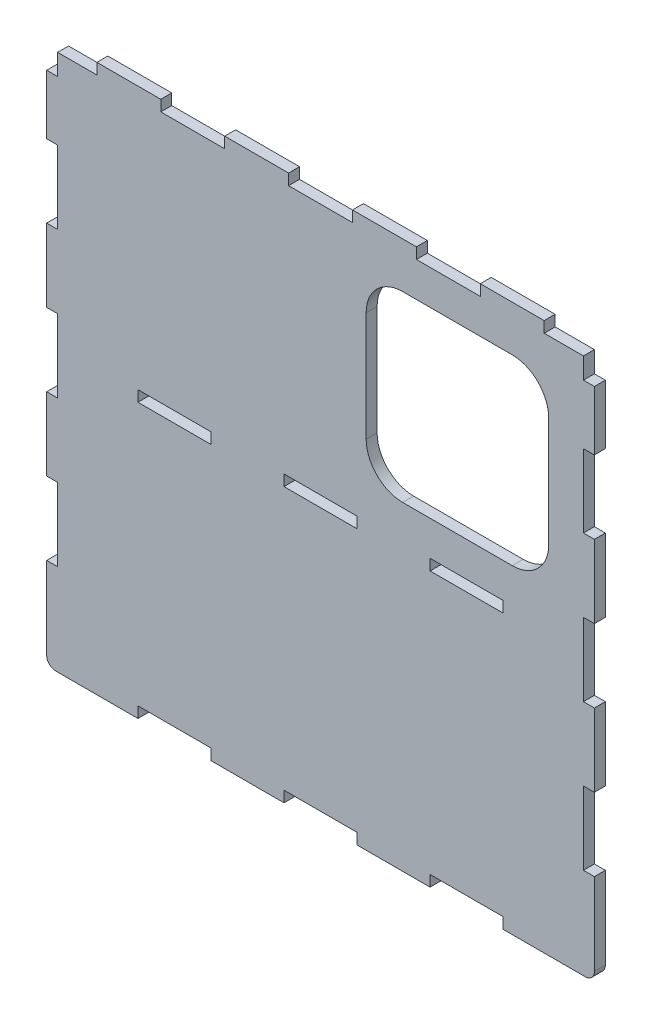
SolidWorks part; units mm, degrees
ref_plane "Alzado" through (0, 0, 0) normal (0, 0, 1) x (1, 0, 0)
ref_plane "Planta" through (0, 0, 0) normal (0, 1, 0) x (1, 0, 0)
ref_plane "Vista lateral" through (0, 0, 0) normal (1, 0, 0) x (0, 0, -1)
sketch "Sketch1" plane through (0, 0, 0) normal (0, 0, 1) x (1, 0, 0)
  line L0 (0, 0) -> (300, 0) construction
  line L2 (-300, 290) -> (-300, 200)
  line L3 (-290, -300) -> (-200, -300)
  line L4 (300, 290) -> (300, 200)
  line L5 (-294.0346, 294.0346) -> (300, -300) construction
  line L6 (-300, -300) -> (300, 300) construction
  line L8 (-200, -300) -> (-200, -288)
  line L9 (-200, -288) -> (-120, -288)
  line L10 (-120, -300) -> (-120, -288)
  line L12 (-40, -300) -> (-40, -288)
  line L13 (-40, -288) -> (40, -288)
  line L14 (40, -300) -> (40, -288)
  line L16 (120, -300) -> (120, -288)
  line L17 (120, -288) -> (200, -288)
  line L18 (200, -300) -> (200, -288)
  line L19 (-120, -300) -> (-40, -300)
  line L20 (40, -300) -> (120, -300)
  line L21 (200, -300) -> (290, -300)
  line L34 (0, 0) -> (0, 288) construction
  line L35 (-300, -200) -> (-288, -200)
  line L37 (-300, -120) -> (-288, -120)
  line L38 (-288, -200) -> (-288, -120)
  line L39 (-300, -40) -> (-288, -40)
  line L41 (-300, 40) -> (-288, 40)
  line L42 (-288, -40) -> (-288, 40)
  line L43 (-300, 120) -> (-288, 120)
  line L45 (-300, 200) -> (-288, 200)
  line L46 (-288, 120) -> (-288, 200)
  line L47 (-300, 120) -> (-300, 40)
  line L48 (-300, -40) -> (-300, -120)
  line L49 (-300, -200) -> (-300, -290)
  line L50 (300, -120) -> (288, -120)
  line L51 (288, -200) -> (288, -120)
  line L52 (300, -200) -> (288, -200)
  line L53 (300, 40) -> (288, 40)
  line L54 (288, -40) -> (288, 40)
  line L55 (300, -40) -> (288, -40)
  line L56 (300, 200) -> (288, 200)
  line L57 (288, 120) -> (288, 200)
  line L58 (300, 120) -> (288, 120)
  line L59 (300, -200) -> (300, -290)
  line L60 (300, -40) -> (300, -120)
  line L61 (300, 120) -> (300, 40)
  line L63 (-175, 288) -> (-105, 288)
  line L64 (-105, 288) -> (-105, 300)
  line L65 (-105, 300) -> (-35, 300)
  line L66 (-35, 300) -> (-35, 288)
  line L67 (-35, 288) -> (35, 288)
  line L68 (35, 288) -> (35, 300)
  line L69 (35, 300) -> (105, 300)
  line L70 (105, 300) -> (105, 288)
  line L71 (105, 288) -> (175, 288)
  line L74 (175, 288) -> (175, 300)
  line L76 (175, 300) -> (290, 300)
  line L77 (-175, 288) -> (-175, 300)
  line L78 (-175, 300) -> (-290, 300)
  arc A0 (290, -300) -> (300, -290) centre (290, -290) ccw
  arc A1 (290, 300) -> (300, 290) centre (290, 290) cw
  arc A2 (-300, -290) -> (-290, -300) centre (-290, -290) ccw
  arc A3 (-290, 300) -> (-300, 290) centre (-290, 290) ccw
  point P0 (0, 0)
  dimension "D3" = 10
  dimension "D2" = 600
  dimension "D4" = 100
  dimension "D5" = 80
  dimension "D6" = 12
  dimension "D7" = 12
  dimension "D8" = 80
  dimension "D9" = 80
  dimension "D10" = 80
  dimension "D11" = 12
  dimension "D12" = 80
  dimension "D13" = 100
  dimension "D14" = 12
  dimension "D15" = 80
  dimension "D16" = 80
  dimension "D17" = 12
  dimension "D18" = 80
  dimension "D19" = 80
  dimension "D20" = 12
  dimension "D21" = 80
  dimension "D22" = 12
  dimension "D23" = 12
  dimension "D24" = 12
  dimension "D25" = 12
  dimension "D26" = 115
  dimension "D27" = 70
  dimension "D28" = 70
  dimension "D29" = 70
  dimension "D30" = 70
  dimension "D31" = 12
  dimension "D32" = 70
  dimension "D33" = 115
  dimension "D34" = 600
extrude "Boss-Extrude1" add sketch "Sketch1" along normal blind 12
sketch "Sketch2" plane through (0, 0, 12) normal (0, 0, 1) x (1, 0, 0)
  line L0 (-300, 290) -> (-300, 200) construction
  line L5 (300, 40) -> (300, 120) construction
  line L6 (90, 250) -> (210, 250)
  line L7 (-300, 265) -> (-288, 265)
  line L8 (-300, 265) -> (-300, 288)
  line L13 (-300, 288) -> (-288, 288)
  line L14 (-288, 265) -> (-288, 288)
  line L19 (-300, 200) -> (-288, 200) construction
  line L20 (50, 210) -> (50, 90)
  line L21 (90, 50) -> (210, 50)
  line L22 (250, 210) -> (250, 90)
  line L23 (50, 250) -> (250, 50) construction
  line L24 (50, 50) -> (250, 250) construction
  line L25 (200, -300) -> (290, -300) construction
  line L26 (-175, 300) -> (-290, 300) construction
  line L27 (-245, 300) -> (-315, 300)
  line L28 (-245, 300) -> (-245, 288)
  line L29 (-245, 288) -> (-315, 288)
  line L30 (-315, 300) -> (-315, 288)
  line L31 (-175, 288) -> (-175, 300) construction
  line L32 (290, 300) -> (175, 300) construction
  line L33 (245, 300) -> (315, 300)
  line L34 (245, 300) -> (245, 288)
  line L35 (245, 288) -> (315, 288)
  line L36 (315, 300) -> (315, 288)
  line L37 (175, 300) -> (175, 288) construction
  line L38 (0, 0) -> (0, 288) construction
  line L39 (35, 288) -> (-35, 288) construction
  line L40 (300, 288) -> (288, 288)
  line L41 (300, 265) -> (300, 288)
  line L42 (288, 265) -> (288, 288)
  line L43 (300, 265) -> (288, 265)
  arc A4 (210, 250) -> (250, 210) centre (210, 210) cw
  arc A5 (210, 50) -> (250, 90) centre (210, 90) ccw
  arc A6 (50, 90) -> (90, 50) centre (90, 90) ccw
  arc A7 (90, 250) -> (50, 210) centre (90, 210) ccw
  point P0 (150, 150)
  dimension "D5" = 40
  dimension "D1" = 200
  dimension "D2" = 200
  dimension "D3" = 50
  dimension "D4" = 350
  dimension "D6" = 70
  dimension "D7" = 12
  dimension "D8" = 70
  dimension "D9" = 12
  dimension "D10" = 70
  dimension "D11" = 70
  dimension "D12" = 65
  dimension "D13" = 12
extrude "Cut-Extrude2" cut sketch "Sketch2" against normal through all contours L43 L41 L35 L42 | L36 L33 L34 L35 | L20 A6 L21 A5 L22 A4 L6 A7 | L27 L30 L29 L28 | L8 L13 L14 L7
sketch "Sketch4" plane through (0, 0, 12) normal (0, 0, 1) x (1, 0, 0)
  line L0 (-300, 12) -> (300, 12) construction
  line L1 (-300, 120) -> (-300, 40) construction
  line L2 (300, 40) -> (300, 120) construction
  line L3 (-245, 288) -> (-288, 288) construction
  line L5 (-200, 12) -> (-120, 12)
  line L6 (-200, 12) -> (-200, 0)
  line L7 (-200, 0) -> (-120, 0)
  line L8 (-120, 12) -> (-120, 0)
  line L9 (-40, 12) -> (40, 12)
  line L10 (-40, 12) -> (-40, 0)
  line L11 (-40, 0) -> (40, 0)
  line L12 (40, 12) -> (40, 0)
  line L13 (120, 12) -> (200, 12)
  line L14 (120, 12) -> (120, 0)
  line L15 (120, 0) -> (200, 0)
  line L16 (200, 12) -> (200, 0)
  dimension "D1" = 276
  dimension "D2" = 12
  dimension "D3" = 100
  dimension "D4" = 80
  dimension "D5" = 80
  dimension "D6" = 80
  dimension "D7" = 80
  dimension "D8" = 80
extrude "Cut-Extrude3" cut sketch "Sketch4" against normal through all
